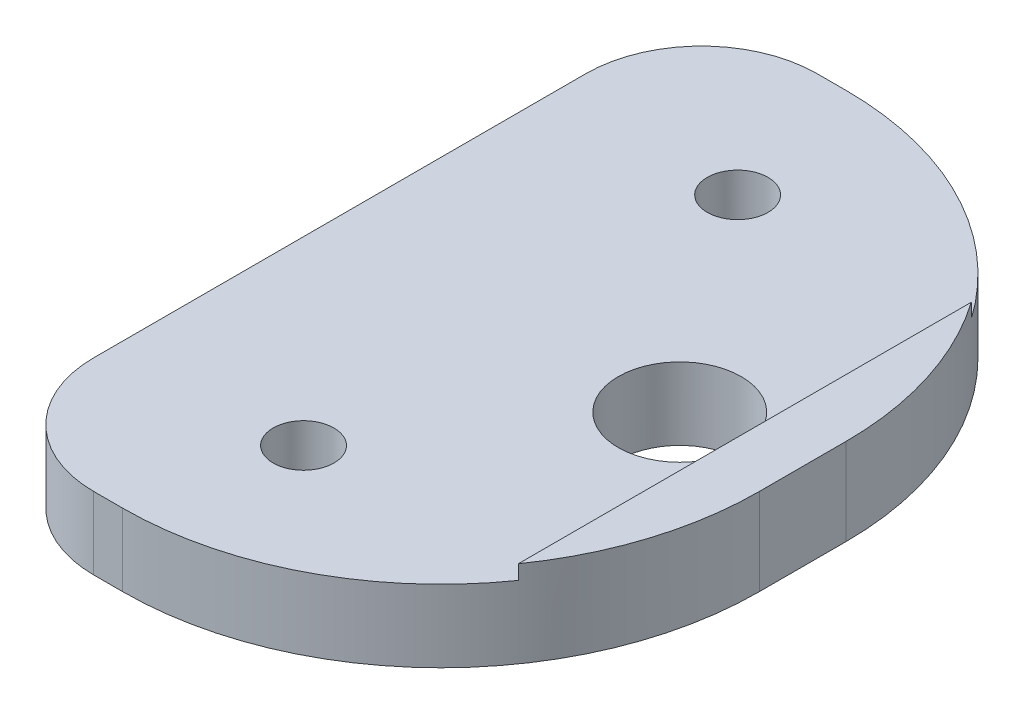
SolidWorks part; units mm, degrees
ref_plane "Face" through (0, 0, 0) normal (0, 0, 1) x (1, 0, 0)
ref_plane "Dessus" through (0, 0, 0) normal (0, 1, 0) x (1, 0, 0)
ref_plane "Droite" through (0, 0, 0) normal (1, 0, 0) x (0, 0, -1)
sketch "Esquisse1" plane through (0, 0, 0) normal (0, 0, 1) x (1, 0, 0)
  line L0 (-16, 0) -> (16, 0)
  line L2 (16, 0) -> (16, 6)
  line L3 (16, 6) -> (12, 6)
  line L4 (12, 6) -> (12, 5)
  line L5 (12, 5) -> (-16, 5)
  line L6 (-16, 0) -> (-16, 5)
  dimension "D1" = 32
  dimension "D3" = 6
  dimension "D4" = 4
  dimension "D5" = 1
extrude "Base-Extrusion" add sketch "Esquisse1" against normal mid plane 50
fillet "Congé1" radius 22 1 edges at (16, 3, 25)
fillet "Congé2" radius 22 3 edges at (12, 5.5, -25) (16, 3, -25) (14, 6, -25)
fillet "Congé3" radius 8 2 edges at (-16, 2.5, -25) (-16, 2.5, 25)
sketch "Esquisse2" plane through (0, 0, 0) normal (0, -1, 0) x (1, 0, 0)
  line L1 (16, -3) -> (16, 3) construction
  circle A0 centre (7.5, 0) radius 4.25
  circle A1 centre (-3.5, -15) radius 2.1
  circle A2 centre (-3.5, 15) radius 2.1
  dimension "D6" = 8.5
  dimension "D7" = 4.2
  dimension "D8" = 4.2
  dimension "D1" = 11
  dimension "D2" = 8.5
  dimension "D3" = 11
  dimension "D4" = 15
  dimension "D5" = 30
extrude "Enlèv. mat.-Extru.1" cut sketch "Esquisse2" against normal through all
other "Bloquer***"
